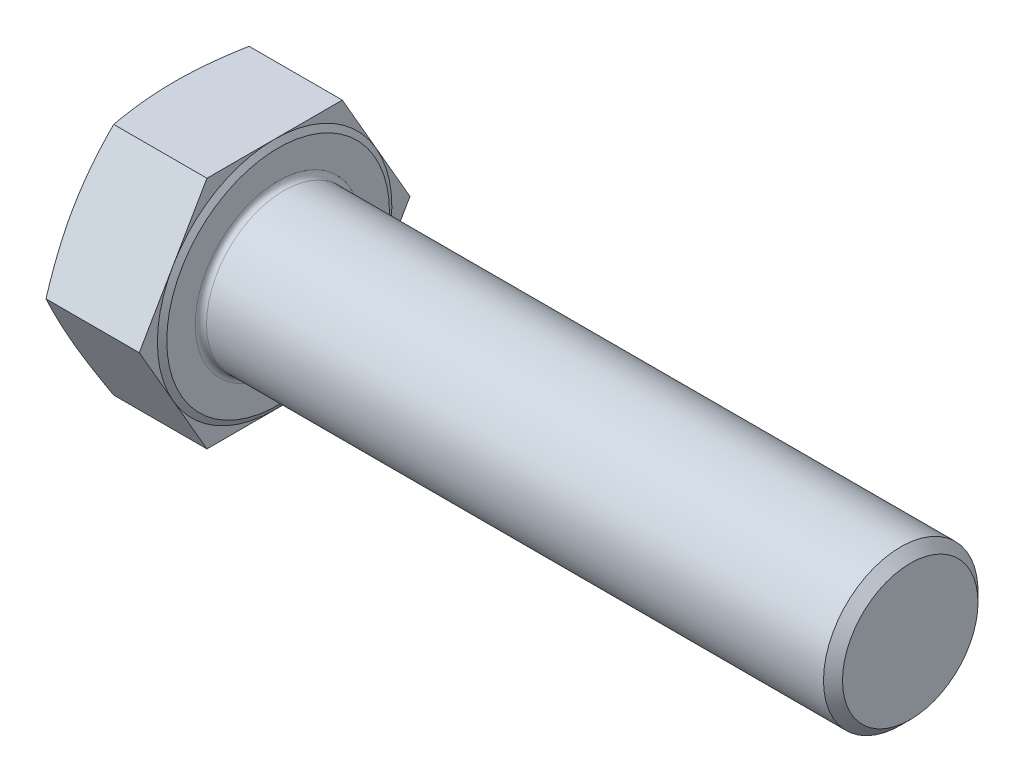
SolidWorks part; units mm, degrees
ref_plane "Front" through (0, 0, 0) normal (0, 0, 1) x (1, 0, 0)
ref_plane "Top" through (0, 0, 0) normal (0, 1, 0) x (1, 0, 0)
ref_plane "Right" through (0, 0, 0) normal (1, 0, 0) x (0, 0, -1)
sketch "Sketch-BaseHead" plane through (0, 0, 0) normal (1, 0, 0) x (0, 0, -1)
  line L1 (19.272, 0) -> (9.636, 16.69)
  line L2 (9.636, 16.69) -> (-9.636, 16.69)
  line L3 (-9.636, 16.69) -> (-19.272, 0)
  line L4 (-19.272, 0) -> (-9.636, -16.69)
  line L5 (-9.636, -16.69) -> (9.636, -16.69)
  line L6 (9.636, -16.69) -> (19.272, 0)
  circle A0 centre (0, 0) radius 16.69 construction
  dimension "s" = 33.38
extrude "BaseHead" add sketch "Sketch-BaseHead" along normal blind 14.22
sketch "Sketch4" plane through (-0.2646, 0, 5.9169) normal (0, 1, 0) x (0, 0, -1)
  line L0 (5.9169, 3.7369) -> (5.9169, -10.4477) construction
  line L2 (25.1888, -0.2646) -> (22.6069, -0.2646)
  line L4 (22.6069, -0.2646) -> (25.1888, -1.2044)
  line L6 (25.1888, -1.2044) -> (25.1888, -0.2646)
  dimension "D1" = 20
  dimension "D2" = 33.38
revolve "HeadChamfer" cut sketch "Sketch4" angle 360 about L0
sketch "Sketch1" plane through (0, 0, 0) normal (0, 0, 1) x (1, 0, 0)
  line L0 (14.22, 0) -> (14.72, 0)
  line L1 (14.72, 0) -> (14.72, -15.855)
  line L2 (14.72, -15.855) -> (14.22, -16.69)
  line L3 (14.22, -16.69) -> (14.22, 0) construction
  line L4 (0, 0) -> (7.5821, 0) construction
  line L5 (-4.0016, 0) -> (10.1831, 0) construction
  line L6 (14.22, -16.69) -> (0.9398, -16.69) construction
  line L7 (14.22, 0) -> (14.22, -16.69)
  dimension "D1" = 16.69
  dimension "c" = 0.5
  dimension "D2" = 15.855
revolve "Revolve1" add sketch "Sketch1" angle 360 about axis through (-4.0016, 0, 0) along (1, 0, 0)
ref_plane "Plane2" through (54.72, 0, 0) normal (1, 0, 0) x (0, 0, -1)
sketch "Sketch3" plane through (14.72, 0, 0) normal (1, 0, 0) x (0, 0, -1)
  circle A0 centre (0, 0) radius 11
  dimension "d" = 22
extrude "BaseBody" add sketch "Sketch3" along normal blind 90
fillet "HeadFillet" radius 0.8 1 edges at (14.72, 0, -11)
chamfer "Chamfer1" distance 1.353 angle 45 1 edges at (104.72, 0, -11)
equation "\"D1@Sketch1\" = \"s@Sketch-BaseHead\"/ 2"
equation "\"D2@Sketch4\" = \"s@Sketch-BaseHead\""
equation "\"D1@Chamfer1\" =  ( \"d@Sketch3\" - \"D2@ThreadCosmetic1\" ) / 2 "
equation "\"b@ThreadCosmetic1\" = \"l@BaseBody\" - \"lg@Plane2\""
